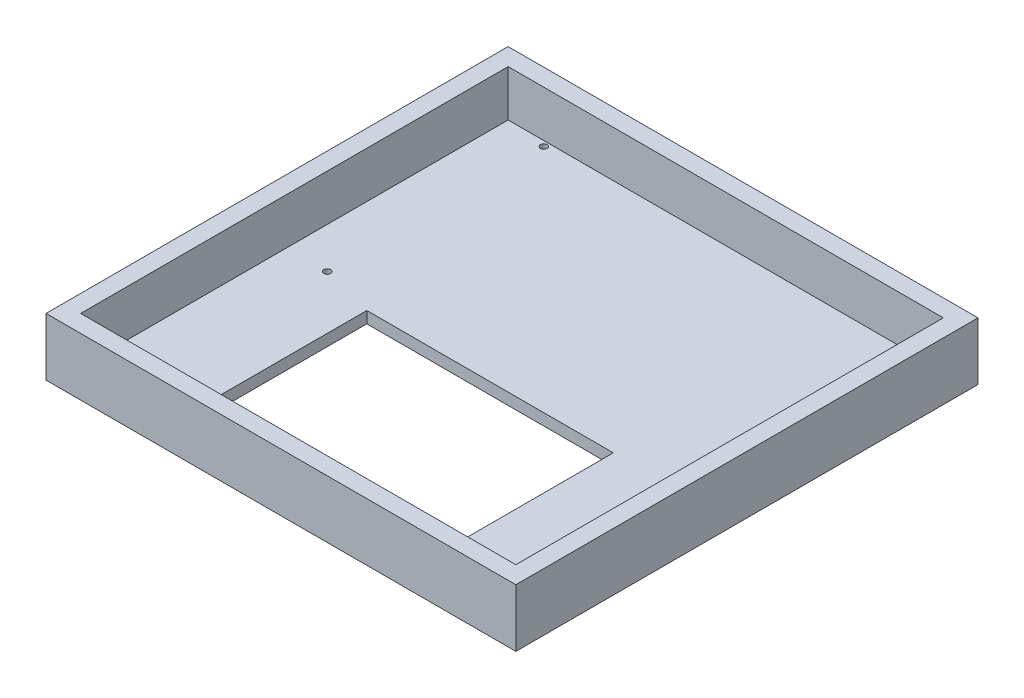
SolidWorks part; units mm, degrees
ref_plane "Front Plane" through (0, 0, 0) normal (0, 0, 1) x (1, 0, 0)
ref_plane "Top Plane" through (0, 0, 0) normal (0, 1, 0) x (1, 0, 0)
ref_plane "Right Plane" through (0, 0, 0) normal (1, 0, 0) x (0, 0, -1)
sketch "Sketch1" plane through (0, 0, 0) normal (0, 1, 0) x (1, 0, 0)
  line L1 (61, -60) -> (-61, -60)
  line L2 (61, -60) -> (61, 60)
  line L3 (61, 60) -> (-61, 60)
  line L4 (-61, -60) -> (-61, 60)
  line L5 (61, -60) -> (-61, 60) construction
  line L6 (61, 60) -> (-61, -60) construction
  point P0 (0, 0)
  dimension "D1" = 120
  dimension "D2" = 122
extrude "Boss-Extrude1" add sketch "Sketch1" along normal blind 15
sketch "Sketch2" plane through (0, 15, 0) normal (0, 1, 0) x (1, 0, 0)
  line L0 (0, 60) -> (0, -60) construction
  line L1 (61, 60) -> (-61, 60) construction
  line L2 (-61, -60) -> (61, -60) construction
  line L3 (61, 34.4848) -> (-61, 34.4848) construction
  line L4 (61, -60) -> (61, 60) construction
  line L5 (-61, 60) -> (-61, -60) construction
  line L13 (56.5, -55.5) -> (-56.5, -55.5)
  line L14 (56.5, -55.5) -> (56.5, 55.5)
  line L15 (56.5, 55.5) -> (-56.5, 55.5)
  line L16 (-56.5, -55.5) -> (-56.5, 55.5)
  line L17 (56.5, -55.5) -> (-56.5, 55.5) construction
  line L18 (56.5, 55.5) -> (-56.5, -55.5) construction
  point P12 (0, 34.4848)
  point P17 (0, 0)
  dimension "D1" = 4.5
  dimension "D2" = 4.5
extrude "Cut-Extrude_BACK" cut sketch "Sketch2" against normal blind 12 contours L16 L15 L14 L13
sketch "Sketch6" plane through (0, 0, 0) normal (0, -1, 0) x (-1, 0, 0)
  line L0 (0, 60) -> (0, -60) construction
  line L1 (-61, 60) -> (61, 60) construction
  line L2 (61, -60) -> (-61, -60) construction
  line L3 (-61, -28.6942) -> (61, -28.6942) construction
  line L4 (-61, -60) -> (-61, 60) construction
  line L5 (61, 60) -> (61, -60) construction
  line L7 (-32, -51.6942) -> (32, -51.6942)
  line L8 (-32, -51.6942) -> (-32, -5.6942)
  line L9 (-32, -5.6942) -> (32, -5.6942)
  line L10 (32, -51.6942) -> (32, -5.6942)
  line L11 (-32, -51.6942) -> (32, -5.6942) construction
  line L12 (-32, -5.6942) -> (32, -51.6942) construction
  point P12 (0, -28.6942)
  dimension "D1" = 8.3058
  dimension "D2" = 64
  dimension "D3" = 46
extrude "Cut-Extrude_TRF7970A" cut sketch "Sketch6" against normal through all
sketch "Sketch8" plane through (0, 3, 0) normal (0, 1, 0) x (1, 0, 0)
  line L0 (0, -5.6942) -> (0, 55.5) construction
  line L1 (-32, -5.6942) -> (32, -5.6942) construction
  line L2 (56.5, 55.5) -> (-56.5, 55.5) construction
  line L3 (46.99, 55.2658) -> (-46.99, 55.2658) construction
  line L4 (-46.99, 55.2658) -> (-46.99, -3.1542) construction
  line L5 (46.99, -3.1542) -> (46.99, 55.2658) construction
  line L6 (-46.99, -3.1542) -> (46.99, -3.1542) construction
  line L8 (46.99, 55.2658) -> (-46.99, -3.1542) construction
  line L9 (46.99, -3.1542) -> (-46.99, 55.2658) construction
  circle A0 centre (-45.8978, 54.1736) radius 0.8763
  circle A1 centre (-45.8978, -2.062) radius 0.8763
  circle A2 centre (45.8978, -2.062) radius 0.8763
  circle A3 centre (45.8978, 54.1736) radius 0.8763
  point P6 (0, 26.0558)
  dimension "D3" = 1.7526
  dimension "D4" = 1.0922
  dimension "D5" = 1.0922
  dimension "D6" = 1.7526
  dimension "D7" = 1.0922
  dimension "D8" = 1.0922
  dimension "D9" = 1.7526
  dimension "D10" = 1.0922
  dimension "D11" = 1.0922
  dimension "D12" = 1.7526
  dimension "D13" = 1.0922
  dimension "D14" = 1.0922
  dimension "D1" = 58.42
  dimension "D2" = 93.98
extrude "Cut-Extrude2" cut sketch "Sketch8" against normal through all
